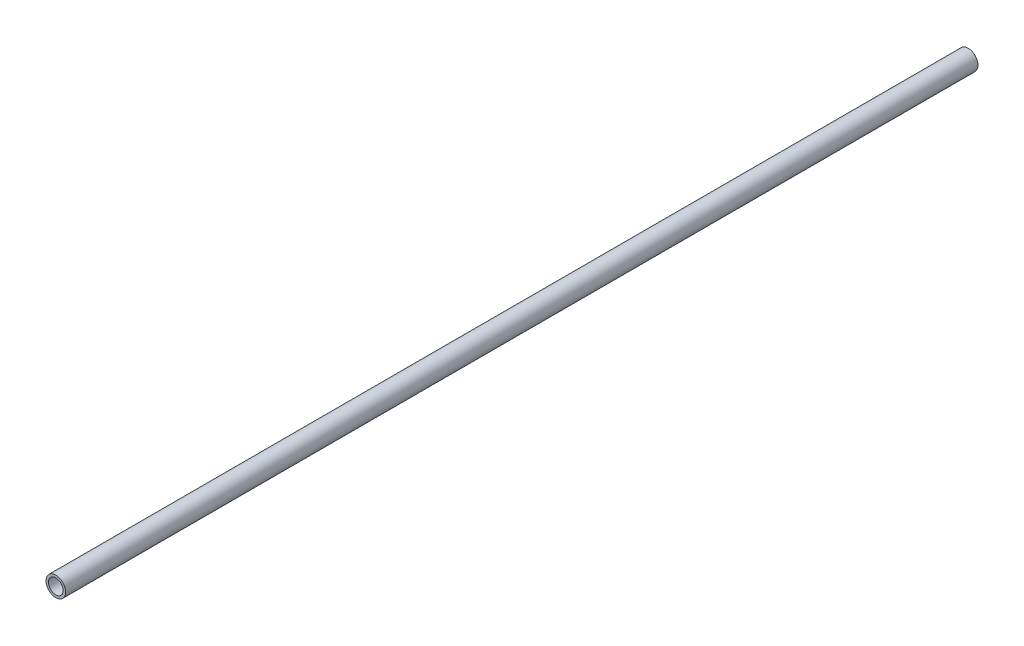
SolidWorks part; units mm, degrees
ref_plane "Front Plane" through (0, 0, 0) normal (0, 0, 1) x (1, 0, 0)
ref_plane "Top Plane" through (0, 0, 0) normal (0, 1, 0) x (1, 0, 0)
ref_plane "Right Plane" through (0, 0, 0) normal (1, 0, 0) x (0, 0, -1)
sketch "Sketch1" plane through (0, 0, 0) normal (0, 0, 1) x (1, 0, 0)
  circle A0 centre (0, 0) radius 6.35
  dimension "D1" = 12.7
extrude "Boss-Extrude1" add sketch "Sketch1" along normal blind 590.55
sketch "Sketch2" plane through (0, 0, 590.55) normal (0, 0, 1) x (1, 0, 0)
  circle A0 centre (0, 0) radius 4.7625
  dimension "D1" = 9.525
extrude "Cut-Extrude1" cut sketch "Sketch2" against normal through all both and the other way through all
